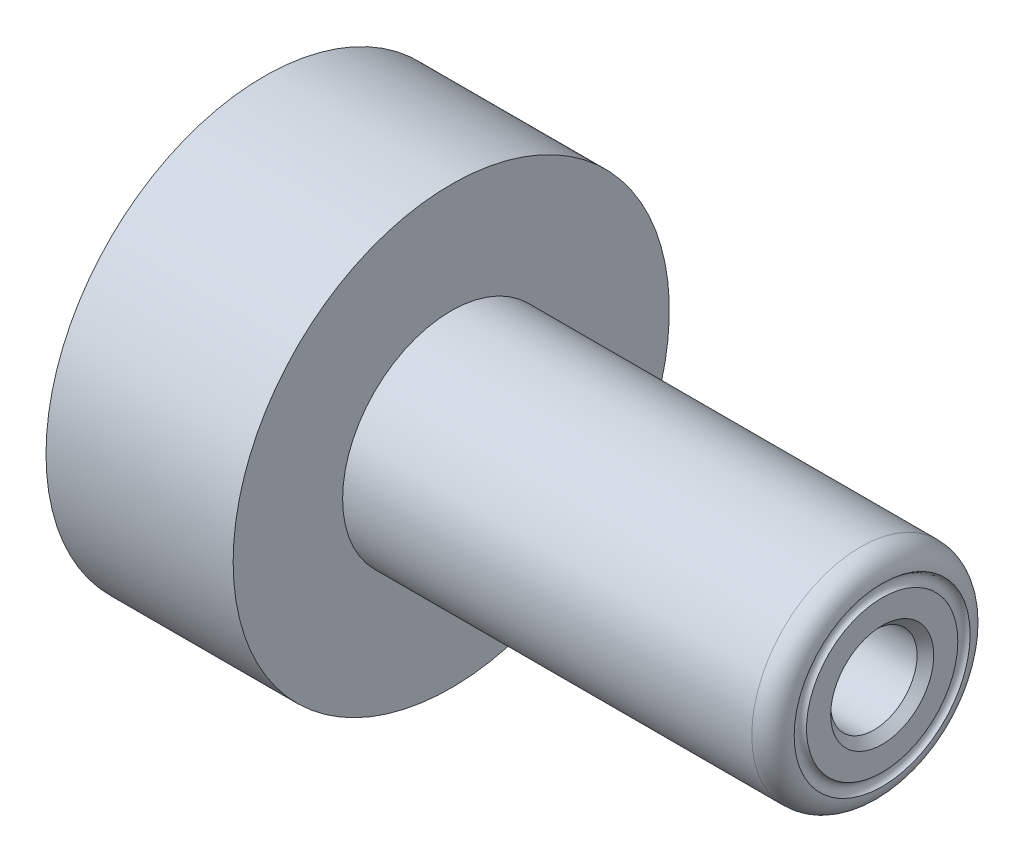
SolidWorks part; units mm, degrees
ref_plane "Front Plane" through (0, 0, 0) normal (0, 0, 1) x (1, 0, 0)
ref_plane "Top Plane" through (0, 0, 0) normal (0, 1, 0) x (1, 0, 0)
ref_plane "Right Plane" through (0, 0, 0) normal (1, 0, 0) x (0, 0, -1)
sketch "Sketch1" plane through (0, 0, 0) normal (0, 0, 1) x (1, 0, 0)
  line L0 (0, 0) -> (102.3864, 0) construction
  line L1 (0, 3.9751) -> (0, 12.7)
  line L2 (0, 12.7) -> (10.8966, 12.7)
  line L3 (10.8966, 12.7) -> (10.8966, 6.3246)
  line L4 (10.8966, 6.3246) -> (34.7218, 6.3246)
  line L5 (35.9918, 5.0546) -> (35.9918, 0)
  line L6 (35.9918, 0) -> (21.8948, 0)
  line L7 (0, 3.9751) -> (21.8948, 3.9751)
  line L8 (21.8948, 3.9751) -> (21.8948, 0)
  arc A0 (35.9918, 5.0546) -> (34.7218, 6.3246) centre (34.7218, 5.0546) ccw
  dimension "D5" = 1.27
  dimension "D1" = 10.8966
  dimension "D2" = 25.4
  dimension "D3" = 21.8948
  dimension "D4" = 7.9502
  dimension "D6" = 35.9918
  dimension "D7" = 12.6492
revolve "Revolve1" add sketch "Sketch1" angle 360 about L0
sketch "Sketch2" plane through (0, 0, 0) normal (-1, 0, 0) x (0, 0, 1)
  line L0 (0, 0) -> (0, 9.7644) construction
  circle A0 centre (-7.1374, 0) radius 1.6129
  circle A1 centre (7.1374, 0) radius 1.6129
  dimension "D2" = 3.2258
  dimension "D1" = 14.2748
extrude "Cut-Extrude1" cut sketch "Sketch2" against normal blind 6.35
sketch "Sketch3" plane through (35.9918, 0, 0) normal (1, 0, 0) x (0, 0, -1)
  circle A0 centre (0, 0) radius 2.515
  dimension "D1" = 5.03
extrude "Cut-Extrude2" cut sketch "Sketch3" against normal through all
chamfer "Chamfer1" distance 0.485 angle 45 1 edges at (35.9918, 0, -2.515)
sketch "Sketch4" plane through (0, 0, 0) normal (0, 0, 1) x (1, 0, 0)
  line L0 (0, 0) -> (38.1985, 0) construction
  line L1 (0, 12.7) -> (0, -12.7) construction
  circle A0 centre (36.117, 4.765) radius 0.381
  dimension "D2" = 4.765
  dimension "D3" = 0.381
  dimension "D1" = 36.117
revolve "Cut-Revolve1" cut sketch "Sketch4" angle 360 about L0
